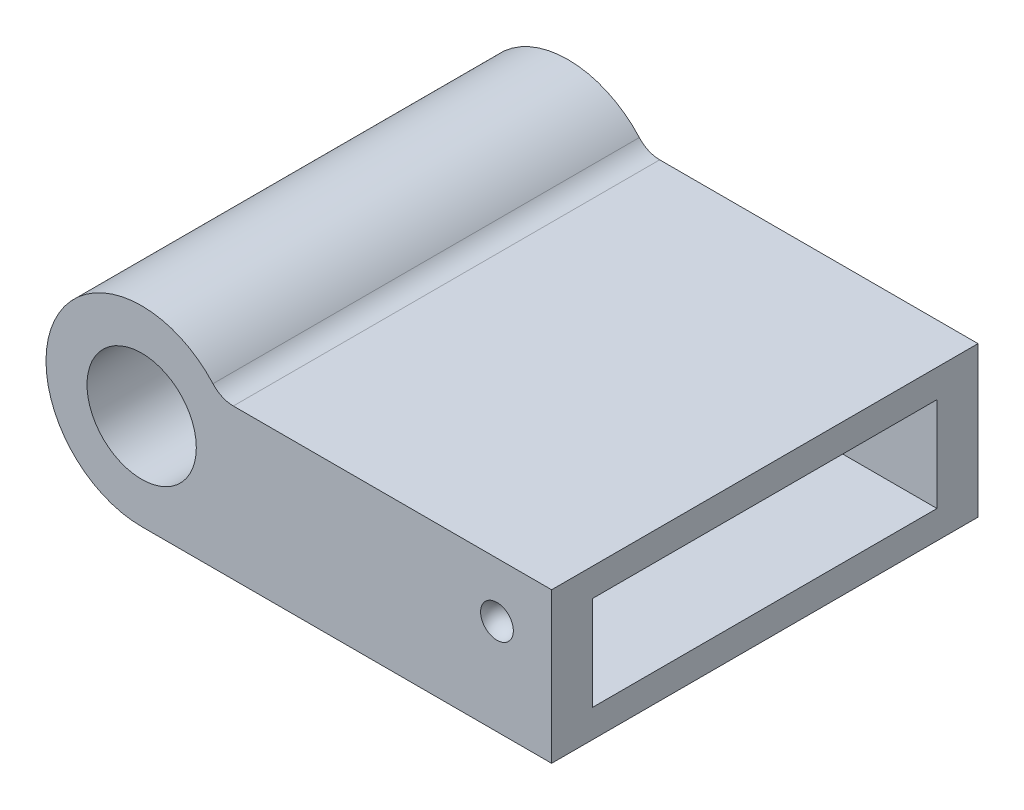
SolidWorks part; units mm, degrees
ref_plane "Plan de face" through (0, 0, 0) normal (0, 0, 1) x (1, 0, 0)
ref_plane "Plan de dessus" through (0, 0, 0) normal (0, 1, 0) x (1, 0, 0)
ref_plane "Plan de droite" through (0, 0, 0) normal (1, 0, 0) x (0, 0, -1)
sketch "Esquisse1" plane through (0, 0, 0) normal (0, 0, 1) x (1, 0, 0)
  line L0 (-26.893, 0) -> (0.9816, 0) construction
  line L1 (0, 23.3763) -> (0, -28.3411) construction
  line L2 (0, -3.5) -> (21.1985, -3.5) construction
  line L3 (0, 3.5) -> (21.7012, 3.5) construction
  line L4 (2.2491, 2) -> (23.4801, 2) construction
  line L5 (1.2823, -2.5) -> (22.2813, -2.5) construction
  line L6 (3.5, 0) -> (3.5, -9.601) construction
  line L7 (6.5, 1.3432) -> (6.5, -4.1096) construction
  line L8 (15, 1.3432) -> (15, -13.5069) construction
  line L9 (2.5971, 0.8) -> (18.066, 0.8) construction
  line L10 (2.8723, 2) -> (15, 2)
  line L11 (15, 2) -> (15, -3.5)
  line L12 (15, -3.5) -> (0, -3.5)
  line L13 (1.5921, 2.4) -> (22.2813, 2.4) construction
  circle A0 centre (0, 0) radius 1.7 construction
  circle A1 centre (0, 0) radius 2 construction
  arc A2 (2.8723, 2) -> (0, -3.5) centre (0, 0) ccw
  dimension "D1" = 1.5
  dimension "D3" = 3
  dimension "D6" = 1.2
  dimension "D7" = 1.1
  dimension "D2" = 1
  dimension "D4" = 8.5
  dimension "D5" = 3.3
extrude "Boss.-Extru.1" add sketch "Esquisse1" along normal mid plane 15.6
sketch "Esquisse2" plane through (15, 0, 0) normal (1, 0, 0) x (0, 0, -1)
  line L0 (-7.8, -0.75) -> (7.8, -0.75) construction
  line L1 (-7.8, -3.5) -> (-7.8, 2) construction
  line L2 (0, 2) -> (0, -3.5) construction
  line L3 (-7.8, 2) -> (7.8, 2) construction
  line L4 (7.8, -3.5) -> (7.8, 2) construction
  line L5 (-6.3, -2.475) -> (6.3, -2.475)
  line L6 (-6.3, -2.475) -> (-6.3, 0.975)
  line L7 (-6.3, 0.975) -> (6.3, 0.975)
  line L8 (6.3, -2.475) -> (6.3, 0.975)
  line L9 (-6.3, -2.475) -> (6.3, 0.975) construction
  line L10 (-6.3, 0.975) -> (6.3, -2.475) construction
  line L11 (-7.8, -3.5) -> (7.8, -3.5) construction
  point P8 (0, -0.75)
  dimension "D1" = 12.6
  dimension "D2" = 3.45
extrude "Enlèv. mat.-Extru.1" cut sketch "Esquisse2" against normal blind 8.6
sketch "Esquisse3" plane through (0, 0, 0) normal (0, 0, 1) x (1, 0, 0)
  circle A0 centre (0, 0) radius 2
extrude "Enlèv. mat.-Extru.2" cut sketch "Esquisse3" against normal mid plane 20
fillet "Congé1" radius 1 1 edges at (2.8723, 2, 0)
sketch "Esquisse4" plane through (0, 0, 0) normal (0, 1, 0) x (1, 0, 0)
  line L0 (0, 8.311) -> (0, -8.4284) construction
  line L1 (-4.3601, 0) -> (16.9943, 0) construction
  line L2 (13, 8.839) -> (13, -8.4284) construction
  line L3 (10.9517, 6.3) -> (14.0415, 6.3) construction
  line L4 (6.4, 6.3) -> (15, 6.3) construction
  line L5 (13, 8.4221) -> (13, 7.2221)
  line L6 (13, -7.2221) -> (13, -8.4221)
  arc A0 (13, -8.4221) -> (13, -7.2221) centre (13, -7.8221) cw
  arc A2 (13, 8.4221) -> (13, 7.2221) centre (13, 7.8221) ccw
  dimension "D1" = 13
revolve "Enlèvement de matière-Révolution1" cut sketch "Esquisse4" angle 360 about L2
